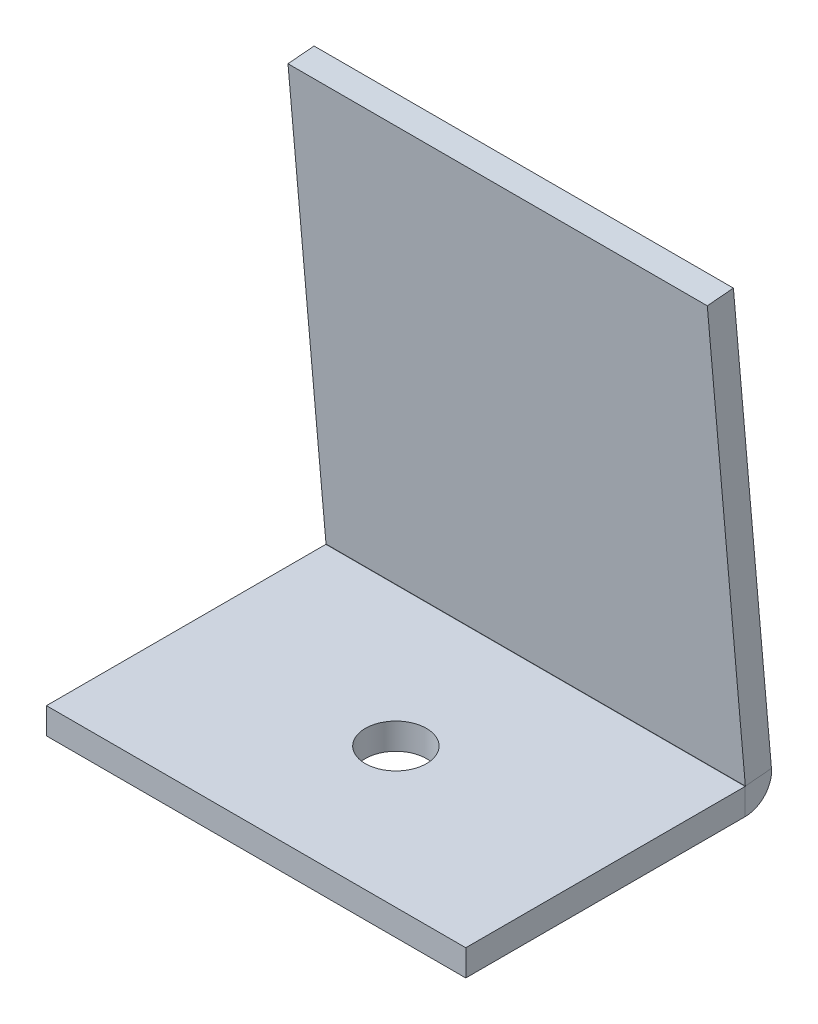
SolidWorks part; units mm, degrees
ref_plane "Front Plane" through (0, 0, 0) normal (0, 0, 1) x (1, 0, 0)
ref_plane "Top Plane" through (0, 0, 0) normal (0, 1, 0) x (1, 0, 0)
ref_plane "Right Plane" through (0, 0, 0) normal (1, 0, 0) x (0, 0, -1)
sketch "Sketch1" plane through (0, 0, 0) normal (0, 1, 0) x (1, 0, 0)
  line L0 (12, 0) -> (12, 41) construction
  line L1 (0, 0) -> (24, 0)
  line L2 (0, 0) -> (0, 41)
  line L3 (0, 41) -> (24, 41)
  line L4 (24, 0) -> (24, 41)
  circle A0 centre (12, 8) radius 1.75
  dimension "D1" = 3.5
  dimension "D2" = 8
  dimension "D3" = 33
  dimension "D4" = 24
sheet metal parameters "Sheet-Metal1" thickness 1.5 parameters "D1"=1
base flange "Base-Flange1" sketch "Sketch1" thickness 1.5 reverse thickness direction yes parameters "D1"=1
sketch "Sketch3" plane through (0, 1.5, 0) normal (0, 1, 0) x (1, 0, 0)
  line L0 (0, 16) -> (24, 16)
  line L1 (0, 41) -> (0, 0) construction
  line L2 (24, 0) -> (24, 41) construction
  line L3 (0, 0) -> (24, 0) construction
  dimension "D1" = 16
sketched bend "Sketched Bend1" parameters "D1"=0.01
bend "SketchBend1" bend radius 0.01 bend angle 95 parameters "D5"=1
flat pattern "Flat-Pattern1"
sketch "Bend-Lines1" plane through (0, 0, 0) normal (0, 1, 0) x (-1, 0, 0)
bend of the flat pattern "Flatten-<SketchBend1>1"
